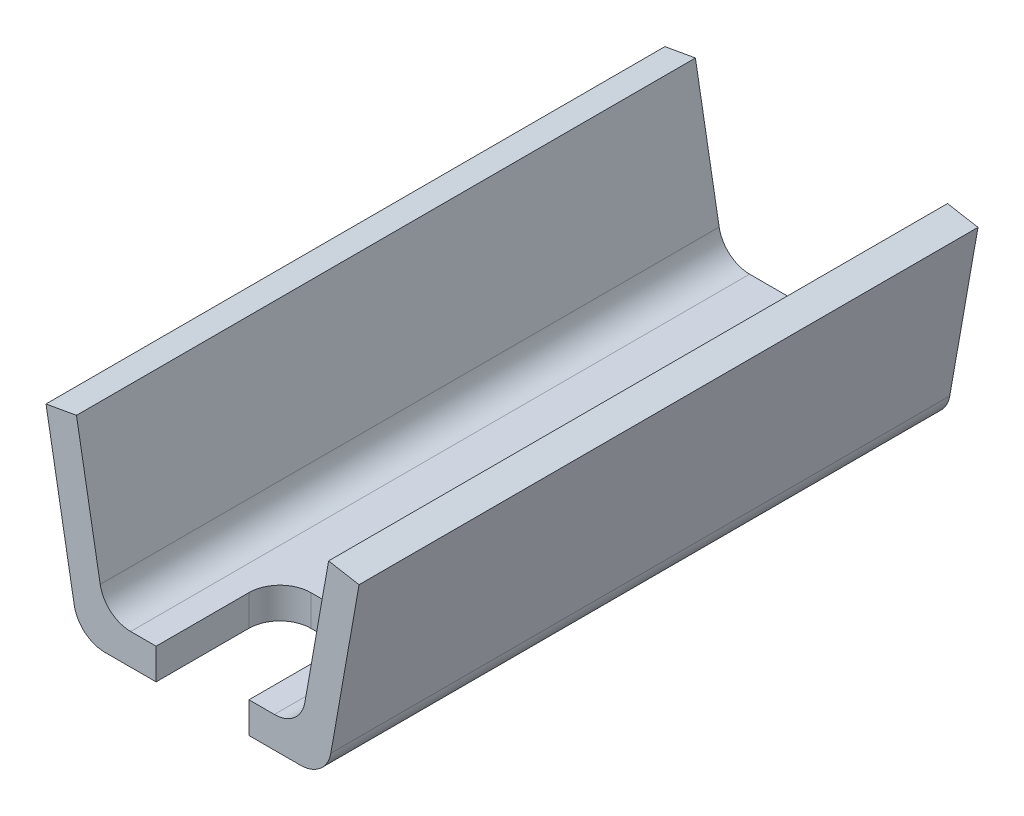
SolidWorks part; units mm, degrees
ref_plane "前视基准面" through (0, 0, 0) normal (0, 0, 1) x (1, 0, 0)
ref_plane "上视基准面" through (0, 0, 0) normal (0, 1, 0) x (1, 0, 0)
ref_plane "右视基准面" through (0, 0, 0) normal (1, 0, 0) x (0, 0, -1)
sketch "草图1" plane through (0, 0, 0) normal (0, 0, 1) x (1, 0, 0)
  line L0 (-15.8045, 0) -> (15.8045, 0)
  line L1 (20.7285, 4.1318) -> (25.2898, 30)
  line L2 (25.2898, 30) -> (20.3658, 30.8682)
  line L3 (20.3658, 30.8682) -> (16.533, 9.1318)
  line L4 (11.609, 5) -> (-11.609, 5)
  line L5 (-16.533, 9.1318) -> (-20.3658, 30.8682)
  line L6 (-20.7285, 4.1318) -> (-25.2898, 30)
  line L7 (-25.2898, 30) -> (-20.3658, 30.8682)
  arc A0 (-11.609, 5) -> (-16.533, 9.1318) centre (-11.609, 10) cw
  arc A1 (11.609, 5) -> (16.533, 9.1318) centre (11.609, 10) ccw
  arc A2 (15.8045, 0) -> (20.7285, 4.1318) centre (15.8045, 5) ccw
  arc A3 (-15.8045, 0) -> (-20.7285, 4.1318) centre (-15.8045, 5) cw
  point P15 (20, 0)
  point P18 (-20, 0)
  dimension "D10" = 5
  dimension "D1" = 5
  dimension "D2" = 5
  dimension "D3" = 5
  dimension "D4" = 40
  dimension "D5" = 20
  dimension "D6" = 100
  dimension "D7" = 100
  dimension "D8" = 30
  dimension "D9" = 30
extrude "拉伸1" add sketch "草图1" along normal blind 100
sketch "草图2" plane through (0, 0, 0) normal (0, -1, 0) x (1, 0, 0)
  line L0 (0, 81.8258) -> (0, 0) construction
  line L1 (-7.5, 100) -> (7.5, 100)
  line L2 (-15.8045, 100) -> (15.8045, 100) construction
  line L3 (7.5, 100) -> (7.5, 85)
  line L4 (2.5, 80) -> (-2.5, 80)
  line L5 (-7.5, 85) -> (-7.5, 100)
  arc A0 (-2.5, 80) -> (-7.5, 85) centre (-2.5, 85) cw
  arc A1 (7.5, 85) -> (2.5, 80) centre (2.5, 85) cw
  point P11 (-7.5, 80)
  point P14 (7.5, 80)
  dimension "D4" = 5
  dimension "D1" = 15
  dimension "D2" = 20
  dimension "D3" = 7.5
extrude "切除-拉伸1" cut sketch "草图2" against normal through all
